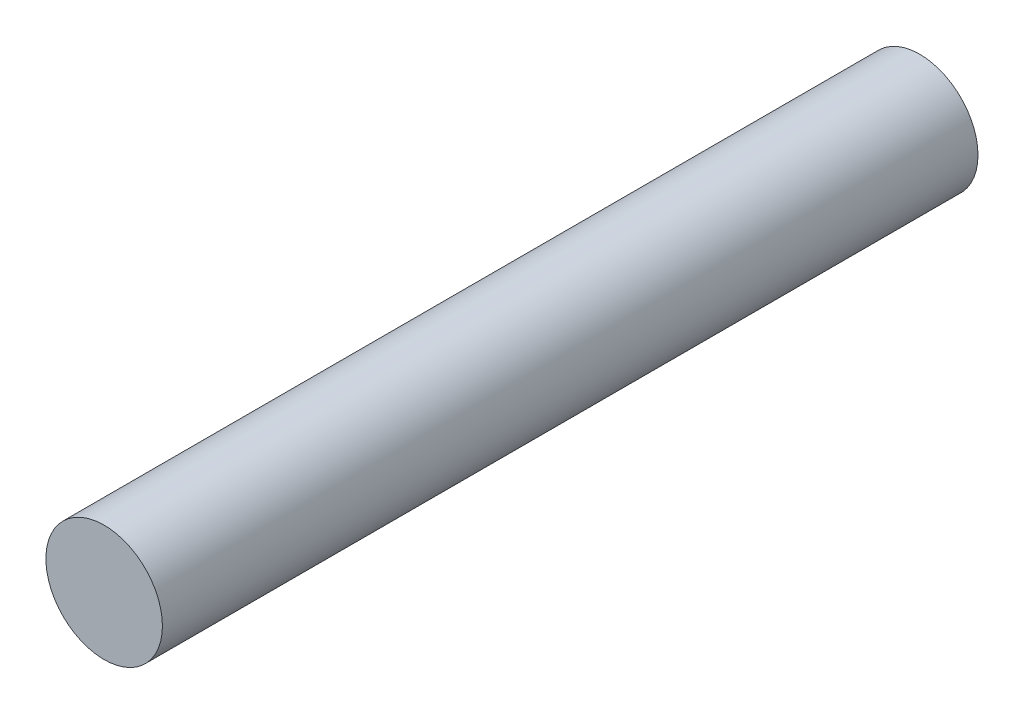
SolidWorks part; units mm, degrees
ref_plane "Front Plane" through (0, 0, 0) normal (0, 0, 1) x (1, 0, 0)
ref_plane "Top Plane" through (0, 0, 0) normal (0, 1, 0) x (1, 0, 0)
ref_plane "Right Plane" through (0, 0, 0) normal (1, 0, 0) x (0, 0, -1)
sketch "Sketch1" plane through (0, 0, 0) normal (0, 0, 1) x (1, 0, 0)
  circle A0 centre (-46.772, 18.2286) radius 3.175
  dimension "D1" = 6.35
extrude "Boss-Extrude1" add sketch "Sketch1" along normal blind 44.45
